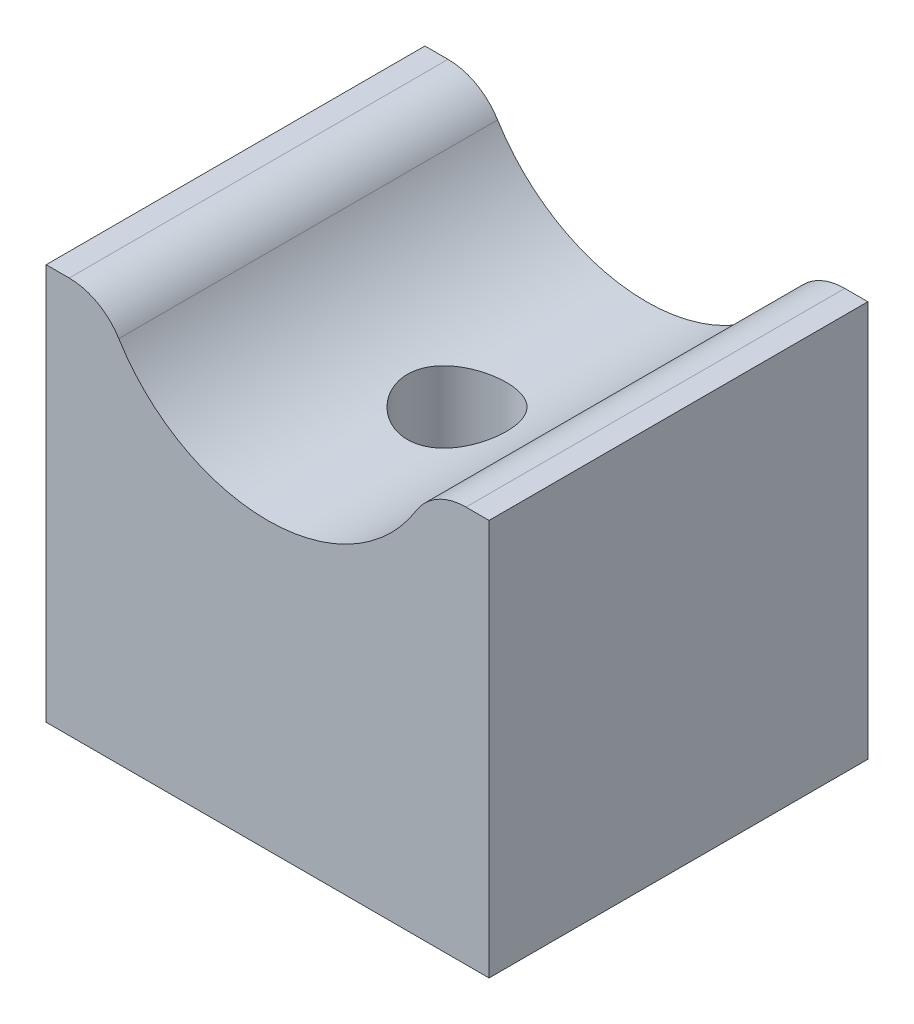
SolidWorks part; units mm, degrees
ref_plane "Ebene vorne" through (0, 0, 0) normal (0, 0, 1) x (1, 0, 0)
ref_plane "Ebene oben" through (0, 0, 0) normal (0, 1, 0) x (1, 0, 0)
ref_plane "Ebene rechts" through (0, 0, 0) normal (1, 0, 0) x (0, 0, -1)
sketch "Skizze1" plane through (0, 0, 0) normal (0, 0, 1) x (1, 0, 0)
  line L0 (13.9553, 34) -> (19, 34)
  line L1 (-19, 0) -> (19, 0)
  line L2 (-19, 0) -> (-19, 34)
  line L3 (-19, 34) -> (-13.9553, 34)
  line L4 (19, 0) -> (19, 34)
  line L5 (-19, 0) -> (19, 34) construction
  line L6 (-19, 34) -> (19, 0) construction
  arc A0 (-13.9553, 34) -> (13.9553, 34) centre (0, 39.5) ccw
  point P0 (0, 17)
  dimension "D3" = 15
  dimension "D1" = 38
  dimension "D2" = 34
  dimension "D4" = 39.5
extrude "Aufsatz-Linear austragen1" add sketch "Skizze1" along normal mid plane 32.5
fillet "Verrundung1" radius 5 2 edges at (13.9553, 34, 0) (-13.9553, 34, 0)
hole_wizard "Stirnsenkung für M10 Zylinderschraube mit Innensechskant1" positions "Skizze3" profile "Skizze2" counterbore size "M10" standard "DIN"
sketch "Skizze3" plane through (0, 0, 0) normal (0, -1, 0) x (1, 0, 0)
  point P0 (0, 0)
sketch "Skizze2" plane through (0, 0, 0) normal (1, 0, 0) x (0, 0, -1)
  line L0 (0, 0) -> (0, 34)
  line L1 (0, 34) -> (4.25, 34)
  line L3 (4.25, 34) -> (4.25, 2)
  line L4 (4.25, 2) -> (7.5, 2)
  line L5 (7.5, 2) -> (7.5, 0)
  line L7 (7.5, 0) -> (0, 0)
  line L11 (0, -6.35) -> (0, 107.95) construction
  dimension "Bohrerdurchmesser" = 8.5
  dimension "Bohrungstiefe" = 34
  dimension "Senkdurchmesser2" = 15
  dimension "Senktiefe2" = 2
